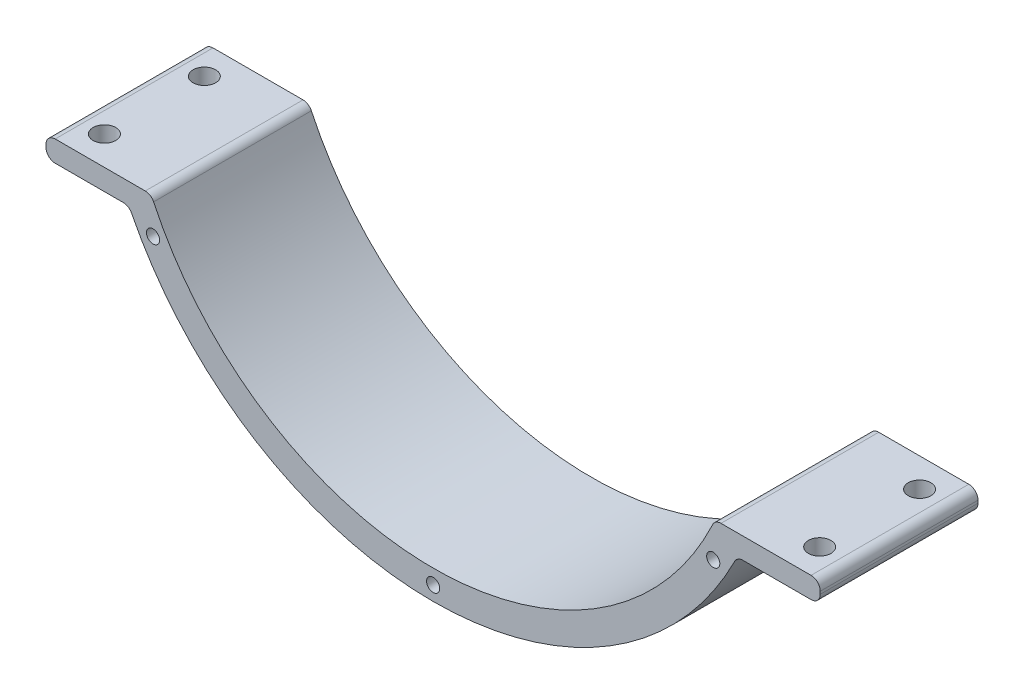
SolidWorks part; units mm, degrees
other "<VBROV-M-CRADLE-EXTRUSION-R1>-<Fillet2>"
ref_plane "Front Plane" through (0, 0, 0) normal (0, 0, 1) x (1, 0, 0)
ref_plane "Top Plane" through (0, 0, 0) normal (0, 1, 0) x (1, 0, 0)
ref_plane "Right Plane" through (0, 0, 0) normal (1, 0, 0) x (0, 0, -1)
inserted part "VBROV-M-CRADLE-EXTRUSION-R1"
